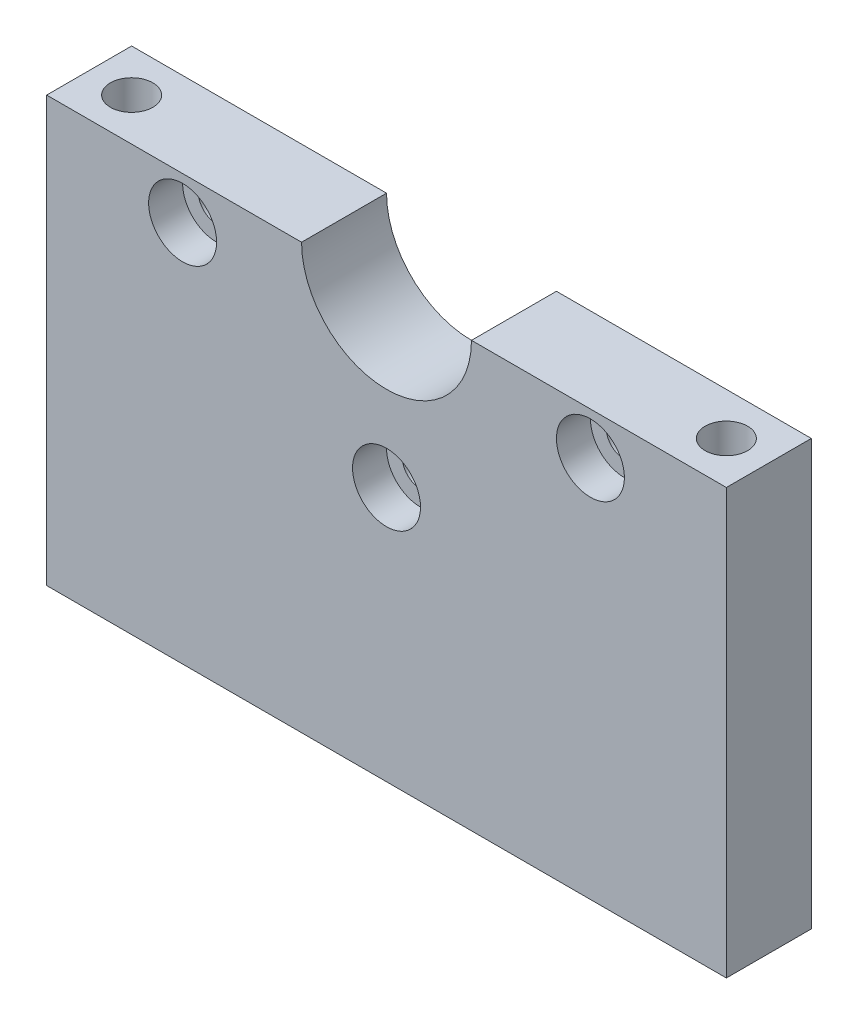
SolidWorks part; units mm, degrees
ref_plane "Front Plane" through (0, 0, 0) normal (0, 0, 1) x (1, 0, 0)
ref_plane "Top Plane" through (0, 0, 0) normal (0, 1, 0) x (1, 0, 0)
ref_plane "Right Plane" through (0, 0, 0) normal (1, 0, 0) x (0, 0, -1)
sketch "Sketch1" plane through (0, 0, 0) normal (0, 0, 1) x (1, 0, 0)
  line L1 (-40, -25) -> (40, -25)
  line L2 (-40, -25) -> (-40, 25)
  line L3 (-40, 25) -> (40, 25)
  line L4 (40, -25) -> (40, 25)
  line L5 (-40, -25) -> (40, 25) construction
  line L6 (-40, 25) -> (40, -25) construction
  point P0 (0, 0)
  dimension "D1" = 80
  dimension "D2" = 50
extrude "Boss-Extrude1" add sketch "Sketch1" along normal mid plane 10
sketch "Sketch2" plane through (0, 0, 5) normal (0, 0, 1) x (1, 0, 0)
  line L0 (40, 25) -> (-40, 25) construction
  circle A0 centre (0, 25) radius 10
  dimension "D1" = 10
  dimension "D2" = 20
extrude "Cut-Extrude1" cut sketch "Sketch2" against normal up to next
hole_wizard "CBORE for M4 SHCS1" positions "Sketch7" profile "Sketch6" counterbore size "M4" standard "ANSI Metric"
sketch "Sketch7" plane through (0, -13.6212, 5) normal (0, 0, 1) x (1, 0, 0)
  line L2 (-40, 38.6212) -> (-40, -11.3788) construction
  line L3 (-10, 38.6212) -> (-40, 38.6212) construction
  line L4 (40, -11.3788) -> (40, 38.6212) construction
  point P0 (-24, 33.6212)
  point P6 (0, 18.6212)
  point P12 (24, 33.6212)
  dimension "D1" = 16
  dimension "D2" = 5
  dimension "D3" = 20
  dimension "D4" = 16
  dimension "D5" = 64
sketch "Sketch6" plane through (-24, 20, 5) normal (1, 0, 0) x (0, -1, 0)
  line L0 (0, 0) -> (0, 10)
  line L1 (0, 10) -> (2.15, 10)
  line L3 (2.15, 10) -> (2.15, 4)
  line L4 (2.15, 4) -> (4, 4)
  line L5 (4, 4) -> (4, 0)
  line L7 (4, 0) -> (0, 0)
  line L11 (0, -6.35) -> (0, 107.95) construction
  dimension "Thru Hole Dia." = 4.3
  dimension "Thru Hole Depth" = 10
  dimension "C'Bore Dia." = 8
  dimension "C'Bore Depth" = 4
sketch "Sketch8" plane through (0, -25, 0) normal (0, -1, 0) x (1, 0, 0)
  line L0 (-25, 0) -> (25, 0) construction
  dimension "D1" = 50
hole_wizard "M4x0.7 Tapped Hole1" positions "Sketch10" profile "Sketch9" tap size "M4x0.7" standard "ANSI Metric"
sketch "Sketch10" plane through (0, -25, 0) normal (0, -1, 0) x (-1, 0, 0)
  point P0 (25, 0)
  point P3 (-25, 0)
sketch "Sketch9" plane through (-25, -25, 0) normal (1, 0, 0) x (0, 0, -1)
  line L0 (0, 0) -> (0, 10.9914)
  line L1 (0, 10.9914) -> (1.65, 10)
  line L2 (1.65, 10) -> (1.65, 0)
  line L5 (1.65, 0) -> (0, 0)
  line L10 (0, 10.9914) -> (-1.65, 10) construction
  line L11 (0, -6.35) -> (0, 107.95) construction
  dimension "Tap Drill Dia." = 3.3
  dimension "Tap Drill Depth" = 10
  dimension "Drill Angle" = 118
sketch "Sketch11" plane through (0, 25, 0) normal (0, 1, 0) x (1, 0, 0)
  line L2 (40, -5) -> (10, -5) construction
  line L3 (40, -5) -> (40, 5) construction
  line L4 (0, 13.522) -> (0, -18.5552) construction
  point P0 (-35, 0)
  point P1 (35, 0)
  dimension "D3" = 5
  dimension "D4" = 5
hole_wizard "M6x1.0 Tapped Hole1" positions "Sketch13" profile "Sketch12" tap size "M6x1.0" standard "ANSI Metric"
sketch "Sketch13" plane through (0, 25, 0) normal (0, 1, 0) x (1, 0, 0)
  point P0 (-35, 0)
  point P3 (35, 0)
sketch "Sketch12" plane through (-35, 25, 0) normal (1, 0, 0) x (0, 0, 1)
  line L0 (0, 0) -> (0, 16.5022)
  line L1 (0, 16.5022) -> (2.5, 15)
  line L2 (2.5, 15) -> (2.5, 0)
  line L5 (2.5, 0) -> (0, 0)
  line L10 (0, 16.5022) -> (-2.5, 15) construction
  line L11 (0, -6.35) -> (0, 107.95) construction
  dimension "Tap Drill Dia." = 5
  dimension "Tap Drill Depth" = 15
  dimension "Drill Angle" = 118
